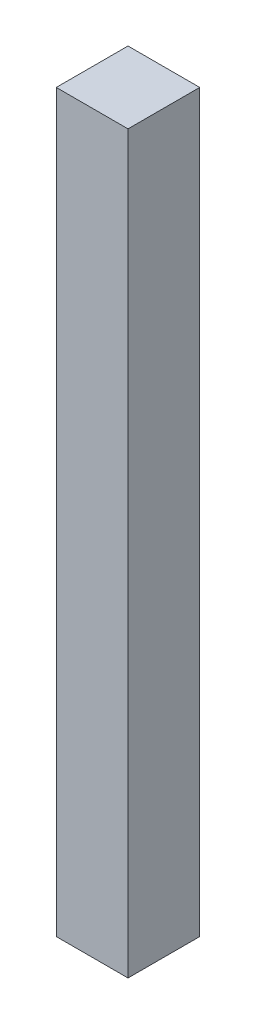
SolidWorks part; units mm, degrees
ref_plane "Plan de face" through (0, 0, 0) normal (0, 0, 1) x (1, 0, 0)
ref_plane "Plan de dessus" through (0, 0, 0) normal (0, 1, 0) x (1, 0, 0)
ref_plane "Plan de droite" through (0, 0, 0) normal (1, 0, 0) x (0, 0, -1)
sketch "Esquisse1" plane through (0, 0, 0) normal (0, 0, 1) x (1, 0, 0)
  line L0 (450, 0) -> (0, 0) construction
  line L1 (450, 410) -> (410, 410)
  line L2 (450, 410) -> (450, 0)
  line L3 (450, 0) -> (410, 0)
  line L4 (410, 410) -> (410, 0)
  dimension "D1" = 40
extrude "Boss.-Extru.1" add sketch "Esquisse1" against normal blind 40
